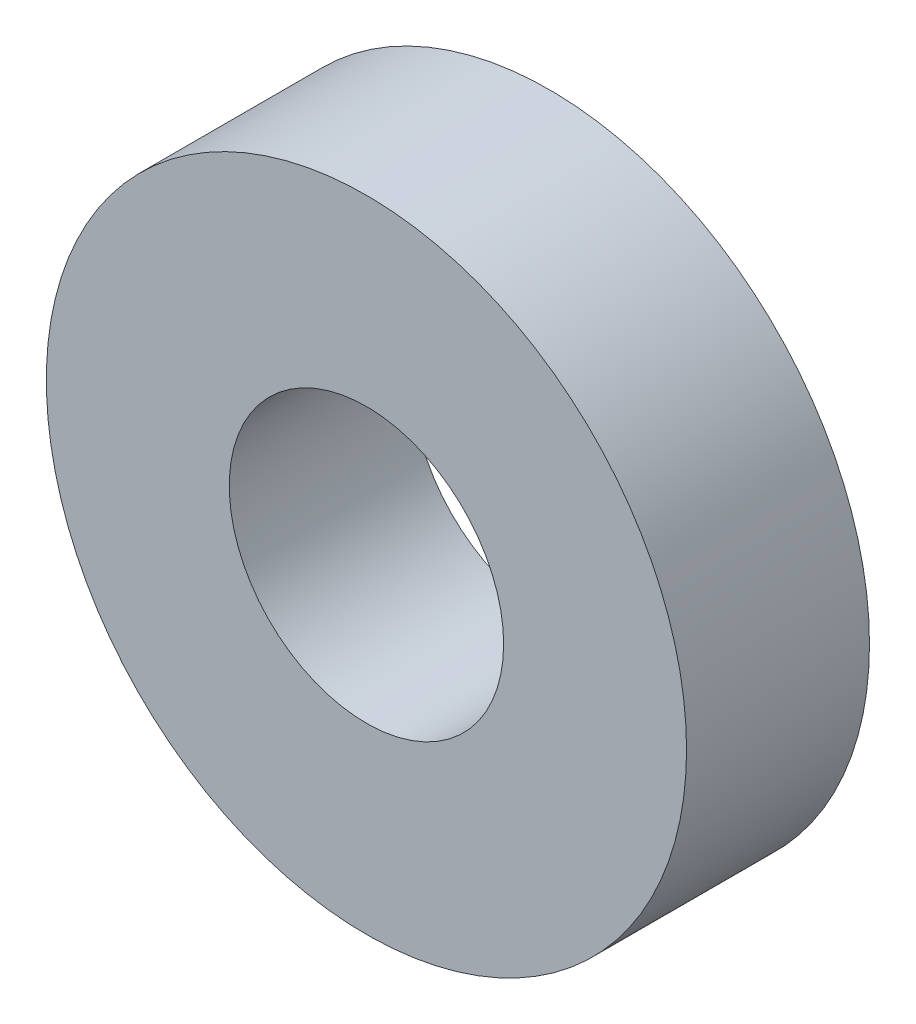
SolidWorks part; units mm, degrees
ref_plane "前视基准面" through (0, 0, 0) normal (0, 0, 1) x (1, 0, 0)
ref_plane "上视基准面" through (0, 0, 0) normal (0, 1, 0) x (1, 0, 0)
ref_plane "右视基准面" through (0, 0, 0) normal (1, 0, 0) x (0, 0, -1)
sketch "草图1" plane through (0, 0, 0) normal (0, 0, 1) x (1, 0, 0)
  circle A0 centre (0, 0) radius 1.5
  circle A1 centre (0, 0) radius 3.5
  dimension "D1" = 3
  dimension "D2" = 7
extrude "凸台-拉伸1" add sketch "草图1" along normal blind 2
